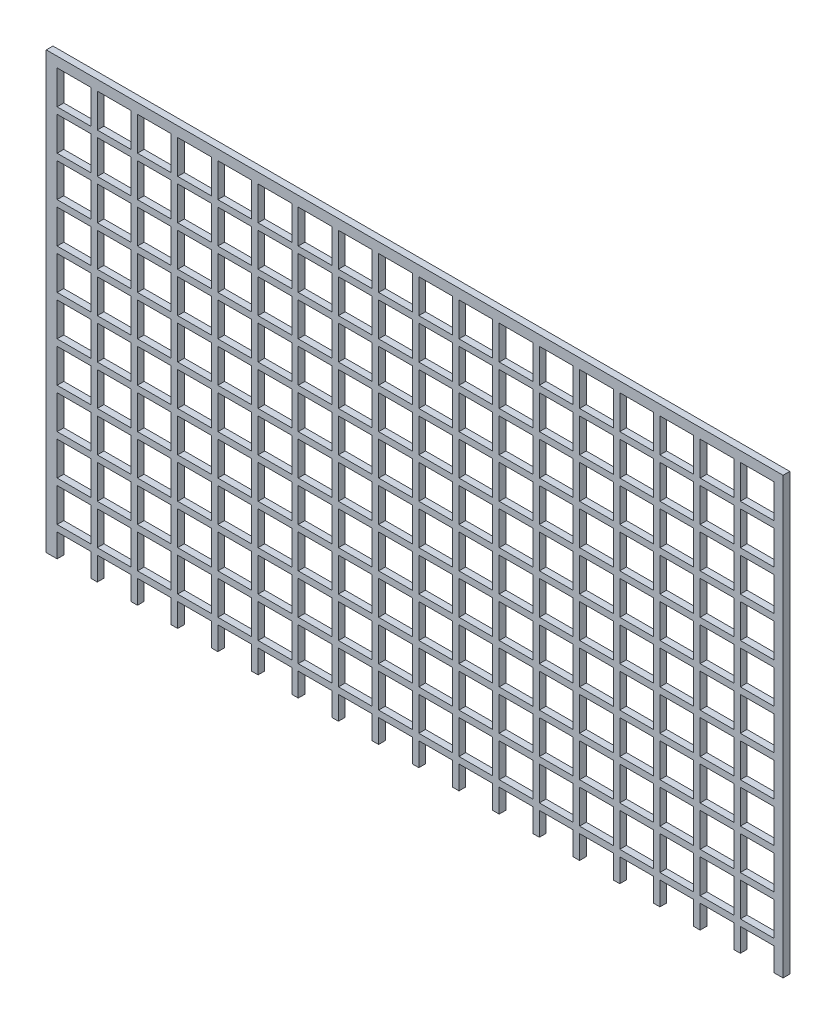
SolidWorks part; units mm, degrees
ref_plane "Front Plane" through (0, 0, 0) normal (0, 0, 1) x (1, 0, 0)
ref_plane "Top Plane" through (0, 0, 0) normal (0, 1, 0) x (1, 0, 0)
ref_plane "Right Plane" through (0, 0, 0) normal (1, 0, 0) x (0, 0, -1)
sketch "Sketch1" plane through (0, 0, 0) normal (0, 0, 1) x (1, 0, 0)
  line L0 (19.3556, 161.2445) -> (32.1389, 161.2445)
  line L1 (0, 0) -> (279.4, 0)
  line L2 (0, 0) -> (0, 165.1)
  line L3 (0, 165.1) -> (279.4, 165.1)
  line L4 (279.4, 0) -> (279.4, 165.1)
  line L5 (4.1156, 161.2445) -> (16.8989, 161.2445)
  line L6 (4.1156, 161.2445) -> (4.1156, 148.4612)
  line L7 (4.1156, 148.4612) -> (16.8989, 148.4612)
  line L8 (16.8989, 161.2445) -> (16.8989, 148.4612)
  line L9 (19.3556, 161.2445) -> (19.3556, 148.4612)
  line L10 (19.3556, 148.4612) -> (32.1389, 148.4612)
  line L11 (32.1389, 161.2445) -> (32.1389, 148.4612)
  line L12 (34.5956, 161.2445) -> (47.3789, 161.2445)
  line L13 (34.5956, 161.2445) -> (34.5956, 148.4612)
  line L14 (34.5956, 148.4612) -> (47.3789, 148.4612)
  line L15 (47.3789, 161.2445) -> (47.3789, 148.4612)
  line L16 (49.8356, 161.2445) -> (62.6189, 161.2445)
  line L17 (49.8356, 161.2445) -> (49.8356, 148.4612)
  line L18 (49.8356, 148.4612) -> (62.6189, 148.4612)
  line L19 (62.6189, 161.2445) -> (62.6189, 148.4612)
  line L20 (65.0756, 161.2445) -> (77.8589, 161.2445)
  line L21 (65.0756, 161.2445) -> (65.0756, 148.4612)
  line L22 (65.0756, 148.4612) -> (77.8589, 148.4612)
  line L23 (77.8589, 161.2445) -> (77.8589, 148.4612)
  line L24 (80.3156, 161.2445) -> (93.0989, 161.2445)
  line L25 (80.3156, 161.2445) -> (80.3156, 148.4612)
  line L26 (80.3156, 148.4612) -> (93.0989, 148.4612)
  line L27 (93.0989, 161.2445) -> (93.0989, 148.4612)
  line L28 (95.5556, 161.2445) -> (108.3389, 161.2445)
  line L29 (95.5556, 161.2445) -> (95.5556, 148.4612)
  line L30 (95.5556, 148.4612) -> (108.3389, 148.4612)
  line L31 (108.3389, 161.2445) -> (108.3389, 148.4612)
  line L32 (110.7956, 161.2445) -> (123.5789, 161.2445)
  line L33 (110.7956, 161.2445) -> (110.7956, 148.4612)
  line L34 (110.7956, 148.4612) -> (123.5789, 148.4612)
  line L35 (123.5789, 161.2445) -> (123.5789, 148.4612)
  line L36 (126.0356, 161.2445) -> (138.8189, 161.2445)
  line L37 (126.0356, 161.2445) -> (126.0356, 148.4612)
  line L38 (126.0356, 148.4612) -> (138.8189, 148.4612)
  line L39 (138.8189, 161.2445) -> (138.8189, 148.4612)
  line L40 (141.2756, 161.2445) -> (154.0589, 161.2445)
  line L41 (141.2756, 161.2445) -> (141.2756, 148.4612)
  line L42 (141.2756, 148.4612) -> (154.0589, 148.4612)
  line L43 (154.0589, 161.2445) -> (154.0589, 148.4612)
  line L44 (156.5156, 161.2445) -> (169.2989, 161.2445)
  line L45 (156.5156, 161.2445) -> (156.5156, 148.4612)
  line L46 (156.5156, 148.4612) -> (169.2989, 148.4612)
  line L47 (169.2989, 161.2445) -> (169.2989, 148.4612)
  line L48 (171.7556, 161.2445) -> (184.5389, 161.2445)
  line L49 (171.7556, 161.2445) -> (171.7556, 148.4612)
  line L50 (171.7556, 148.4612) -> (184.5389, 148.4612)
  line L51 (184.5389, 161.2445) -> (184.5389, 148.4612)
  line L52 (186.9956, 161.2445) -> (199.7789, 161.2445)
  line L53 (186.9956, 161.2445) -> (186.9956, 148.4612)
  line L54 (186.9956, 148.4612) -> (199.7789, 148.4612)
  line L55 (199.7789, 161.2445) -> (199.7789, 148.4612)
  line L56 (202.2356, 161.2445) -> (215.0189, 161.2445)
  line L57 (202.2356, 161.2445) -> (202.2356, 148.4612)
  line L58 (202.2356, 148.4612) -> (215.0189, 148.4612)
  line L59 (215.0189, 161.2445) -> (215.0189, 148.4612)
  line L60 (217.4756, 161.2445) -> (230.2589, 161.2445)
  line L61 (217.4756, 161.2445) -> (217.4756, 148.4612)
  line L62 (217.4756, 148.4612) -> (230.2589, 148.4612)
  line L63 (230.2589, 161.2445) -> (230.2589, 148.4612)
  line L64 (232.7156, 161.2445) -> (245.4989, 161.2445)
  line L65 (232.7156, 161.2445) -> (232.7156, 148.4612)
  line L66 (232.7156, 148.4612) -> (245.4989, 148.4612)
  line L67 (245.4989, 161.2445) -> (245.4989, 148.4612)
  line L68 (247.9556, 161.2445) -> (260.7389, 161.2445)
  line L69 (247.9556, 161.2445) -> (247.9556, 148.4612)
  line L70 (247.9556, 148.4612) -> (260.7389, 148.4612)
  line L71 (260.7389, 161.2445) -> (260.7389, 148.4612)
  line L72 (263.1956, 161.2445) -> (275.9789, 161.2445)
  line L73 (263.1956, 161.2445) -> (263.1956, 148.4612)
  line L74 (263.1956, 148.4612) -> (275.9789, 148.4612)
  line L75 (275.9789, 161.2445) -> (275.9789, 148.4612)
  line L76 (19.3556, 146.0045) -> (32.1389, 146.0045)
  line L77 (19.3556, 146.0045) -> (19.3556, 133.2212)
  line L78 (19.3556, 133.2212) -> (32.1389, 133.2212)
  line L79 (32.1389, 146.0045) -> (32.1389, 133.2212)
  line L80 (34.5956, 146.0045) -> (47.3789, 146.0045)
  line L81 (34.5956, 146.0045) -> (34.5956, 133.2212)
  line L82 (34.5956, 133.2212) -> (47.3789, 133.2212)
  line L83 (47.3789, 146.0045) -> (47.3789, 133.2212)
  line L84 (49.8356, 146.0045) -> (62.6189, 146.0045)
  line L85 (49.8356, 146.0045) -> (49.8356, 133.2212)
  line L86 (49.8356, 133.2212) -> (62.6189, 133.2212)
  line L87 (62.6189, 146.0045) -> (62.6189, 133.2212)
  line L88 (65.0756, 146.0045) -> (77.8589, 146.0045)
  line L89 (65.0756, 146.0045) -> (65.0756, 133.2212)
  line L90 (65.0756, 133.2212) -> (77.8589, 133.2212)
  line L91 (77.8589, 146.0045) -> (77.8589, 133.2212)
  line L92 (80.3156, 146.0045) -> (93.0989, 146.0045)
  line L93 (80.3156, 146.0045) -> (80.3156, 133.2212)
  line L94 (80.3156, 133.2212) -> (93.0989, 133.2212)
  line L95 (93.0989, 146.0045) -> (93.0989, 133.2212)
  line L96 (95.5556, 146.0045) -> (108.3389, 146.0045)
  line L97 (95.5556, 146.0045) -> (95.5556, 133.2212)
  line L98 (95.5556, 133.2212) -> (108.3389, 133.2212)
  line L99 (108.3389, 146.0045) -> (108.3389, 133.2212)
  line L100 (110.7956, 146.0045) -> (123.5789, 146.0045)
  line L101 (110.7956, 146.0045) -> (110.7956, 133.2212)
  line L102 (110.7956, 133.2212) -> (123.5789, 133.2212)
  line L103 (123.5789, 146.0045) -> (123.5789, 133.2212)
  line L104 (126.0356, 146.0045) -> (138.8189, 146.0045)
  line L105 (126.0356, 146.0045) -> (126.0356, 133.2212)
  line L106 (126.0356, 133.2212) -> (138.8189, 133.2212)
  line L107 (138.8189, 146.0045) -> (138.8189, 133.2212)
  line L108 (141.2756, 146.0045) -> (154.0589, 146.0045)
  line L109 (141.2756, 146.0045) -> (141.2756, 133.2212)
  line L110 (141.2756, 133.2212) -> (154.0589, 133.2212)
  line L111 (154.0589, 146.0045) -> (154.0589, 133.2212)
  line L112 (156.5156, 146.0045) -> (169.2989, 146.0045)
  line L113 (156.5156, 146.0045) -> (156.5156, 133.2212)
  line L114 (156.5156, 133.2212) -> (169.2989, 133.2212)
  line L115 (169.2989, 146.0045) -> (169.2989, 133.2212)
  line L116 (171.7556, 146.0045) -> (184.5389, 146.0045)
  line L117 (171.7556, 146.0045) -> (171.7556, 133.2212)
  line L118 (171.7556, 133.2212) -> (184.5389, 133.2212)
  line L119 (184.5389, 146.0045) -> (184.5389, 133.2212)
  line L120 (186.9956, 146.0045) -> (199.7789, 146.0045)
  line L121 (186.9956, 146.0045) -> (186.9956, 133.2212)
  line L122 (186.9956, 133.2212) -> (199.7789, 133.2212)
  line L123 (199.7789, 146.0045) -> (199.7789, 133.2212)
  line L124 (202.2356, 146.0045) -> (215.0189, 146.0045)
  line L125 (202.2356, 146.0045) -> (202.2356, 133.2212)
  line L126 (202.2356, 133.2212) -> (215.0189, 133.2212)
  line L127 (215.0189, 146.0045) -> (215.0189, 133.2212)
  line L128 (217.4756, 146.0045) -> (230.2589, 146.0045)
  line L129 (217.4756, 146.0045) -> (217.4756, 133.2212)
  line L130 (217.4756, 133.2212) -> (230.2589, 133.2212)
  line L131 (230.2589, 146.0045) -> (230.2589, 133.2212)
  line L132 (232.7156, 146.0045) -> (245.4989, 146.0045)
  line L133 (232.7156, 146.0045) -> (232.7156, 133.2212)
  line L134 (232.7156, 133.2212) -> (245.4989, 133.2212)
  line L135 (245.4989, 146.0045) -> (245.4989, 133.2212)
  line L136 (247.9556, 146.0045) -> (260.7389, 146.0045)
  line L137 (247.9556, 146.0045) -> (247.9556, 133.2212)
  line L138 (247.9556, 133.2212) -> (260.7389, 133.2212)
  line L139 (260.7389, 146.0045) -> (260.7389, 133.2212)
  line L140 (263.1956, 146.0045) -> (275.9789, 146.0045)
  line L141 (263.1956, 146.0045) -> (263.1956, 133.2212)
  line L142 (263.1956, 133.2212) -> (275.9789, 133.2212)
  line L143 (275.9789, 146.0045) -> (275.9789, 133.2212)
  line L144 (19.3556, 130.7645) -> (32.1389, 130.7645)
  line L145 (19.3556, 130.7645) -> (19.3556, 117.9812)
  line L146 (19.3556, 117.9812) -> (32.1389, 117.9812)
  line L147 (32.1389, 130.7645) -> (32.1389, 117.9812)
  line L148 (34.5956, 130.7645) -> (47.3789, 130.7645)
  line L149 (34.5956, 130.7645) -> (34.5956, 117.9812)
  line L150 (34.5956, 117.9812) -> (47.3789, 117.9812)
  line L151 (47.3789, 130.7645) -> (47.3789, 117.9812)
  line L152 (49.8356, 130.7645) -> (62.6189, 130.7645)
  line L153 (49.8356, 130.7645) -> (49.8356, 117.9812)
  line L154 (49.8356, 117.9812) -> (62.6189, 117.9812)
  line L155 (62.6189, 130.7645) -> (62.6189, 117.9812)
  line L156 (65.0756, 130.7645) -> (77.8589, 130.7645)
  line L157 (65.0756, 130.7645) -> (65.0756, 117.9812)
  line L158 (65.0756, 117.9812) -> (77.8589, 117.9812)
  line L159 (77.8589, 130.7645) -> (77.8589, 117.9812)
  line L160 (80.3156, 130.7645) -> (93.0989, 130.7645)
  line L161 (80.3156, 130.7645) -> (80.3156, 117.9812)
  line L162 (80.3156, 117.9812) -> (93.0989, 117.9812)
  line L163 (93.0989, 130.7645) -> (93.0989, 117.9812)
  line L164 (95.5556, 130.7645) -> (108.3389, 130.7645)
  line L165 (95.5556, 130.7645) -> (95.5556, 117.9812)
  line L166 (95.5556, 117.9812) -> (108.3389, 117.9812)
  line L167 (108.3389, 130.7645) -> (108.3389, 117.9812)
  line L168 (110.7956, 130.7645) -> (123.5789, 130.7645)
  line L169 (110.7956, 130.7645) -> (110.7956, 117.9812)
  line L170 (110.7956, 117.9812) -> (123.5789, 117.9812)
  line L171 (123.5789, 130.7645) -> (123.5789, 117.9812)
  line L172 (126.0356, 130.7645) -> (138.8189, 130.7645)
  line L173 (126.0356, 130.7645) -> (126.0356, 117.9812)
  line L174 (126.0356, 117.9812) -> (138.8189, 117.9812)
  line L175 (138.8189, 130.7645) -> (138.8189, 117.9812)
  line L176 (141.2756, 130.7645) -> (154.0589, 130.7645)
  line L177 (141.2756, 130.7645) -> (141.2756, 117.9812)
  line L178 (141.2756, 117.9812) -> (154.0589, 117.9812)
  line L179 (154.0589, 130.7645) -> (154.0589, 117.9812)
  line L180 (156.5156, 130.7645) -> (169.2989, 130.7645)
  line L181 (156.5156, 130.7645) -> (156.5156, 117.9812)
  line L182 (156.5156, 117.9812) -> (169.2989, 117.9812)
  line L183 (169.2989, 130.7645) -> (169.2989, 117.9812)
  line L184 (171.7556, 130.7645) -> (184.5389, 130.7645)
  line L185 (171.7556, 130.7645) -> (171.7556, 117.9812)
  line L186 (171.7556, 117.9812) -> (184.5389, 117.9812)
  line L187 (184.5389, 130.7645) -> (184.5389, 117.9812)
  line L188 (186.9956, 130.7645) -> (199.7789, 130.7645)
  line L189 (186.9956, 130.7645) -> (186.9956, 117.9812)
  line L190 (186.9956, 117.9812) -> (199.7789, 117.9812)
  line L191 (199.7789, 130.7645) -> (199.7789, 117.9812)
  line L192 (202.2356, 130.7645) -> (215.0189, 130.7645)
  line L193 (202.2356, 130.7645) -> (202.2356, 117.9812)
  line L194 (202.2356, 117.9812) -> (215.0189, 117.9812)
  line L195 (215.0189, 130.7645) -> (215.0189, 117.9812)
  line L196 (217.4756, 130.7645) -> (230.2589, 130.7645)
  line L197 (217.4756, 130.7645) -> (217.4756, 117.9812)
  line L198 (217.4756, 117.9812) -> (230.2589, 117.9812)
  line L199 (230.2589, 130.7645) -> (230.2589, 117.9812)
  line L200 (232.7156, 130.7645) -> (245.4989, 130.7645)
  line L201 (232.7156, 130.7645) -> (232.7156, 117.9812)
  line L202 (232.7156, 117.9812) -> (245.4989, 117.9812)
  line L203 (245.4989, 130.7645) -> (245.4989, 117.9812)
  line L204 (247.9556, 130.7645) -> (260.7389, 130.7645)
  line L205 (247.9556, 130.7645) -> (247.9556, 117.9812)
  line L206 (247.9556, 117.9812) -> (260.7389, 117.9812)
  line L207 (260.7389, 130.7645) -> (260.7389, 117.9812)
  line L208 (263.1956, 130.7645) -> (275.9789, 130.7645)
  line L209 (263.1956, 130.7645) -> (263.1956, 117.9812)
  line L210 (263.1956, 117.9812) -> (275.9789, 117.9812)
  line L211 (275.9789, 130.7645) -> (275.9789, 117.9812)
  line L212 (19.3556, 115.5245) -> (32.1389, 115.5245)
  line L213 (19.3556, 115.5245) -> (19.3556, 102.7412)
  line L214 (19.3556, 102.7412) -> (32.1389, 102.7412)
  line L215 (32.1389, 115.5245) -> (32.1389, 102.7412)
  line L216 (34.5956, 115.5245) -> (47.3789, 115.5245)
  line L217 (34.5956, 115.5245) -> (34.5956, 102.7412)
  line L218 (34.5956, 102.7412) -> (47.3789, 102.7412)
  line L219 (47.3789, 115.5245) -> (47.3789, 102.7412)
  line L220 (49.8356, 115.5245) -> (62.6189, 115.5245)
  line L221 (49.8356, 115.5245) -> (49.8356, 102.7412)
  line L222 (49.8356, 102.7412) -> (62.6189, 102.7412)
  line L223 (62.6189, 115.5245) -> (62.6189, 102.7412)
  line L224 (65.0756, 115.5245) -> (77.8589, 115.5245)
  line L225 (65.0756, 115.5245) -> (65.0756, 102.7412)
  line L226 (65.0756, 102.7412) -> (77.8589, 102.7412)
  line L227 (77.8589, 115.5245) -> (77.8589, 102.7412)
  line L228 (80.3156, 115.5245) -> (93.0989, 115.5245)
  line L229 (80.3156, 115.5245) -> (80.3156, 102.7412)
  line L230 (80.3156, 102.7412) -> (93.0989, 102.7412)
  line L231 (93.0989, 115.5245) -> (93.0989, 102.7412)
  line L232 (95.5556, 115.5245) -> (108.3389, 115.5245)
  line L233 (95.5556, 115.5245) -> (95.5556, 102.7412)
  line L234 (95.5556, 102.7412) -> (108.3389, 102.7412)
  line L235 (108.3389, 115.5245) -> (108.3389, 102.7412)
  line L236 (110.7956, 115.5245) -> (123.5789, 115.5245)
  line L237 (110.7956, 115.5245) -> (110.7956, 102.7412)
  line L238 (110.7956, 102.7412) -> (123.5789, 102.7412)
  line L239 (123.5789, 115.5245) -> (123.5789, 102.7412)
  line L240 (126.0356, 115.5245) -> (138.8189, 115.5245)
  line L241 (126.0356, 115.5245) -> (126.0356, 102.7412)
  line L242 (126.0356, 102.7412) -> (138.8189, 102.7412)
  line L243 (138.8189, 115.5245) -> (138.8189, 102.7412)
  line L244 (141.2756, 115.5245) -> (154.0589, 115.5245)
  line L245 (141.2756, 115.5245) -> (141.2756, 102.7412)
  line L246 (141.2756, 102.7412) -> (154.0589, 102.7412)
  line L247 (154.0589, 115.5245) -> (154.0589, 102.7412)
  line L248 (156.5156, 115.5245) -> (169.2989, 115.5245)
  line L249 (156.5156, 115.5245) -> (156.5156, 102.7412)
  line L250 (156.5156, 102.7412) -> (169.2989, 102.7412)
  line L251 (169.2989, 115.5245) -> (169.2989, 102.7412)
  line L252 (171.7556, 115.5245) -> (184.5389, 115.5245)
  line L253 (171.7556, 115.5245) -> (171.7556, 102.7412)
  line L254 (171.7556, 102.7412) -> (184.5389, 102.7412)
  line L255 (184.5389, 115.5245) -> (184.5389, 102.7412)
  line L256 (186.9956, 115.5245) -> (199.7789, 115.5245)
  line L257 (186.9956, 115.5245) -> (186.9956, 102.7412)
  line L258 (186.9956, 102.7412) -> (199.7789, 102.7412)
  line L259 (199.7789, 115.5245) -> (199.7789, 102.7412)
  line L260 (202.2356, 115.5245) -> (215.0189, 115.5245)
  line L261 (202.2356, 115.5245) -> (202.2356, 102.7412)
  line L262 (202.2356, 102.7412) -> (215.0189, 102.7412)
  line L263 (215.0189, 115.5245) -> (215.0189, 102.7412)
  line L264 (217.4756, 115.5245) -> (230.2589, 115.5245)
  line L265 (217.4756, 115.5245) -> (217.4756, 102.7412)
  line L266 (217.4756, 102.7412) -> (230.2589, 102.7412)
  line L267 (230.2589, 115.5245) -> (230.2589, 102.7412)
  line L268 (232.7156, 115.5245) -> (245.4989, 115.5245)
  line L269 (232.7156, 115.5245) -> (232.7156, 102.7412)
  line L270 (232.7156, 102.7412) -> (245.4989, 102.7412)
  line L271 (245.4989, 115.5245) -> (245.4989, 102.7412)
  line L272 (247.9556, 115.5245) -> (260.7389, 115.5245)
  line L273 (247.9556, 115.5245) -> (247.9556, 102.7412)
  line L274 (247.9556, 102.7412) -> (260.7389, 102.7412)
  line L275 (260.7389, 115.5245) -> (260.7389, 102.7412)
  line L276 (263.1956, 115.5245) -> (275.9789, 115.5245)
  line L277 (263.1956, 115.5245) -> (263.1956, 102.7412)
  line L278 (263.1956, 102.7412) -> (275.9789, 102.7412)
  line L279 (275.9789, 115.5245) -> (275.9789, 102.7412)
  line L280 (19.3556, 100.2845) -> (32.1389, 100.2845)
  line L281 (19.3556, 100.2845) -> (19.3556, 87.5012)
  line L282 (19.3556, 87.5012) -> (32.1389, 87.5012)
  line L283 (32.1389, 100.2845) -> (32.1389, 87.5012)
  line L284 (34.5956, 100.2845) -> (47.3789, 100.2845)
  line L285 (34.5956, 100.2845) -> (34.5956, 87.5012)
  line L286 (34.5956, 87.5012) -> (47.3789, 87.5012)
  line L287 (47.3789, 100.2845) -> (47.3789, 87.5012)
  line L288 (49.8356, 100.2845) -> (62.6189, 100.2845)
  line L289 (49.8356, 100.2845) -> (49.8356, 87.5012)
  line L290 (49.8356, 87.5012) -> (62.6189, 87.5012)
  line L291 (62.6189, 100.2845) -> (62.6189, 87.5012)
  line L292 (65.0756, 100.2845) -> (77.8589, 100.2845)
  line L293 (65.0756, 100.2845) -> (65.0756, 87.5012)
  line L294 (65.0756, 87.5012) -> (77.8589, 87.5012)
  line L295 (77.8589, 100.2845) -> (77.8589, 87.5012)
  line L296 (80.3156, 100.2845) -> (93.0989, 100.2845)
  line L297 (80.3156, 100.2845) -> (80.3156, 87.5012)
  line L298 (80.3156, 87.5012) -> (93.0989, 87.5012)
  line L299 (93.0989, 100.2845) -> (93.0989, 87.5012)
  line L300 (95.5556, 100.2845) -> (108.3389, 100.2845)
  line L301 (95.5556, 100.2845) -> (95.5556, 87.5012)
  line L302 (95.5556, 87.5012) -> (108.3389, 87.5012)
  line L303 (108.3389, 100.2845) -> (108.3389, 87.5012)
  line L304 (110.7956, 100.2845) -> (123.5789, 100.2845)
  line L305 (110.7956, 100.2845) -> (110.7956, 87.5012)
  line L306 (110.7956, 87.5012) -> (123.5789, 87.5012)
  line L307 (123.5789, 100.2845) -> (123.5789, 87.5012)
  line L308 (126.0356, 100.2845) -> (138.8189, 100.2845)
  line L309 (126.0356, 100.2845) -> (126.0356, 87.5012)
  line L310 (126.0356, 87.5012) -> (138.8189, 87.5012)
  line L311 (138.8189, 100.2845) -> (138.8189, 87.5012)
  line L312 (141.2756, 100.2845) -> (154.0589, 100.2845)
  line L313 (141.2756, 100.2845) -> (141.2756, 87.5012)
  line L314 (141.2756, 87.5012) -> (154.0589, 87.5012)
  line L315 (154.0589, 100.2845) -> (154.0589, 87.5012)
  line L316 (156.5156, 100.2845) -> (169.2989, 100.2845)
  line L317 (156.5156, 100.2845) -> (156.5156, 87.5012)
  line L318 (156.5156, 87.5012) -> (169.2989, 87.5012)
  line L319 (169.2989, 100.2845) -> (169.2989, 87.5012)
  line L320 (171.7556, 100.2845) -> (184.5389, 100.2845)
  line L321 (171.7556, 100.2845) -> (171.7556, 87.5012)
  line L322 (171.7556, 87.5012) -> (184.5389, 87.5012)
  line L323 (184.5389, 100.2845) -> (184.5389, 87.5012)
  line L324 (186.9956, 100.2845) -> (199.7789, 100.2845)
  line L325 (186.9956, 100.2845) -> (186.9956, 87.5012)
  line L326 (186.9956, 87.5012) -> (199.7789, 87.5012)
  line L327 (199.7789, 100.2845) -> (199.7789, 87.5012)
  line L328 (202.2356, 100.2845) -> (215.0189, 100.2845)
  line L329 (202.2356, 100.2845) -> (202.2356, 87.5012)
  line L330 (202.2356, 87.5012) -> (215.0189, 87.5012)
  line L331 (215.0189, 100.2845) -> (215.0189, 87.5012)
  line L332 (217.4756, 100.2845) -> (230.2589, 100.2845)
  line L333 (217.4756, 100.2845) -> (217.4756, 87.5012)
  line L334 (217.4756, 87.5012) -> (230.2589, 87.5012)
  line L335 (230.2589, 100.2845) -> (230.2589, 87.5012)
  line L336 (232.7156, 100.2845) -> (245.4989, 100.2845)
  line L337 (232.7156, 100.2845) -> (232.7156, 87.5012)
  line L338 (232.7156, 87.5012) -> (245.4989, 87.5012)
  line L339 (245.4989, 100.2845) -> (245.4989, 87.5012)
  line L340 (247.9556, 100.2845) -> (260.7389, 100.2845)
  line L341 (247.9556, 100.2845) -> (247.9556, 87.5012)
  line L342 (247.9556, 87.5012) -> (260.7389, 87.5012)
  line L343 (260.7389, 100.2845) -> (260.7389, 87.5012)
  line L344 (263.1956, 100.2845) -> (275.9789, 100.2845)
  line L345 (263.1956, 100.2845) -> (263.1956, 87.5012)
  line L346 (263.1956, 87.5012) -> (275.9789, 87.5012)
  line L347 (275.9789, 100.2845) -> (275.9789, 87.5012)
  line L348 (19.3556, 85.0445) -> (32.1389, 85.0445)
  line L349 (19.3556, 85.0445) -> (19.3556, 72.2612)
  line L350 (19.3556, 72.2612) -> (32.1389, 72.2612)
  line L351 (32.1389, 85.0445) -> (32.1389, 72.2612)
  line L352 (34.5956, 85.0445) -> (47.3789, 85.0445)
  line L353 (34.5956, 85.0445) -> (34.5956, 72.2612)
  line L354 (34.5956, 72.2612) -> (47.3789, 72.2612)
  line L355 (47.3789, 85.0445) -> (47.3789, 72.2612)
  line L356 (49.8356, 85.0445) -> (62.6189, 85.0445)
  line L357 (49.8356, 85.0445) -> (49.8356, 72.2612)
  line L358 (49.8356, 72.2612) -> (62.6189, 72.2612)
  line L359 (62.6189, 85.0445) -> (62.6189, 72.2612)
  line L360 (65.0756, 85.0445) -> (77.8589, 85.0445)
  line L361 (65.0756, 85.0445) -> (65.0756, 72.2612)
  line L362 (65.0756, 72.2612) -> (77.8589, 72.2612)
  line L363 (77.8589, 85.0445) -> (77.8589, 72.2612)
  line L364 (80.3156, 85.0445) -> (93.0989, 85.0445)
  line L365 (80.3156, 85.0445) -> (80.3156, 72.2612)
  line L366 (80.3156, 72.2612) -> (93.0989, 72.2612)
  line L367 (93.0989, 85.0445) -> (93.0989, 72.2612)
  line L368 (95.5556, 85.0445) -> (108.3389, 85.0445)
  line L369 (95.5556, 85.0445) -> (95.5556, 72.2612)
  line L370 (95.5556, 72.2612) -> (108.3389, 72.2612)
  line L371 (108.3389, 85.0445) -> (108.3389, 72.2612)
  line L372 (110.7956, 85.0445) -> (123.5789, 85.0445)
  line L373 (110.7956, 85.0445) -> (110.7956, 72.2612)
  line L374 (110.7956, 72.2612) -> (123.5789, 72.2612)
  line L375 (123.5789, 85.0445) -> (123.5789, 72.2612)
  line L376 (126.0356, 85.0445) -> (138.8189, 85.0445)
  line L377 (126.0356, 85.0445) -> (126.0356, 72.2612)
  line L378 (126.0356, 72.2612) -> (138.8189, 72.2612)
  line L379 (138.8189, 85.0445) -> (138.8189, 72.2612)
  line L380 (141.2756, 85.0445) -> (154.0589, 85.0445)
  line L381 (141.2756, 85.0445) -> (141.2756, 72.2612)
  line L382 (141.2756, 72.2612) -> (154.0589, 72.2612)
  line L383 (154.0589, 85.0445) -> (154.0589, 72.2612)
  line L384 (156.5156, 85.0445) -> (169.2989, 85.0445)
  line L385 (156.5156, 85.0445) -> (156.5156, 72.2612)
  line L386 (156.5156, 72.2612) -> (169.2989, 72.2612)
  line L387 (169.2989, 85.0445) -> (169.2989, 72.2612)
  line L388 (171.7556, 85.0445) -> (184.5389, 85.0445)
  line L389 (171.7556, 85.0445) -> (171.7556, 72.2612)
  line L390 (171.7556, 72.2612) -> (184.5389, 72.2612)
  line L391 (184.5389, 85.0445) -> (184.5389, 72.2612)
  line L392 (186.9956, 85.0445) -> (199.7789, 85.0445)
  line L393 (186.9956, 85.0445) -> (186.9956, 72.2612)
  line L394 (186.9956, 72.2612) -> (199.7789, 72.2612)
  line L395 (199.7789, 85.0445) -> (199.7789, 72.2612)
  line L396 (202.2356, 85.0445) -> (215.0189, 85.0445)
  line L397 (202.2356, 85.0445) -> (202.2356, 72.2612)
  line L398 (202.2356, 72.2612) -> (215.0189, 72.2612)
  line L399 (215.0189, 85.0445) -> (215.0189, 72.2612)
  line L400 (217.4756, 85.0445) -> (230.2589, 85.0445)
  line L401 (217.4756, 85.0445) -> (217.4756, 72.2612)
  line L402 (217.4756, 72.2612) -> (230.2589, 72.2612)
  line L403 (230.2589, 85.0445) -> (230.2589, 72.2612)
  line L404 (232.7156, 85.0445) -> (245.4989, 85.0445)
  line L405 (232.7156, 85.0445) -> (232.7156, 72.2612)
  line L406 (232.7156, 72.2612) -> (245.4989, 72.2612)
  line L407 (245.4989, 85.0445) -> (245.4989, 72.2612)
  line L408 (247.9556, 85.0445) -> (260.7389, 85.0445)
  line L409 (247.9556, 85.0445) -> (247.9556, 72.2612)
  line L410 (247.9556, 72.2612) -> (260.7389, 72.2612)
  line L411 (260.7389, 85.0445) -> (260.7389, 72.2612)
  line L412 (263.1956, 85.0445) -> (275.9789, 85.0445)
  line L413 (263.1956, 85.0445) -> (263.1956, 72.2612)
  line L414 (263.1956, 72.2612) -> (275.9789, 72.2612)
  line L415 (275.9789, 85.0445) -> (275.9789, 72.2612)
  line L416 (19.3556, 69.8045) -> (32.1389, 69.8045)
  line L417 (19.3556, 69.8045) -> (19.3556, 57.0212)
  line L418 (19.3556, 57.0212) -> (32.1389, 57.0212)
  line L419 (32.1389, 69.8045) -> (32.1389, 57.0212)
  line L420 (34.5956, 69.8045) -> (47.3789, 69.8045)
  line L421 (34.5956, 69.8045) -> (34.5956, 57.0212)
  line L422 (34.5956, 57.0212) -> (47.3789, 57.0212)
  line L423 (47.3789, 69.8045) -> (47.3789, 57.0212)
  line L424 (49.8356, 69.8045) -> (62.6189, 69.8045)
  line L425 (49.8356, 69.8045) -> (49.8356, 57.0212)
  line L426 (49.8356, 57.0212) -> (62.6189, 57.0212)
  line L427 (62.6189, 69.8045) -> (62.6189, 57.0212)
  line L428 (65.0756, 69.8045) -> (77.8589, 69.8045)
  line L429 (65.0756, 69.8045) -> (65.0756, 57.0212)
  line L430 (65.0756, 57.0212) -> (77.8589, 57.0212)
  line L431 (77.8589, 69.8045) -> (77.8589, 57.0212)
  line L432 (80.3156, 69.8045) -> (93.0989, 69.8045)
  line L433 (80.3156, 69.8045) -> (80.3156, 57.0212)
  line L434 (80.3156, 57.0212) -> (93.0989, 57.0212)
  line L435 (93.0989, 69.8045) -> (93.0989, 57.0212)
  line L436 (95.5556, 69.8045) -> (108.3389, 69.8045)
  line L437 (95.5556, 69.8045) -> (95.5556, 57.0212)
  line L438 (95.5556, 57.0212) -> (108.3389, 57.0212)
  line L439 (108.3389, 69.8045) -> (108.3389, 57.0212)
  line L440 (110.7956, 69.8045) -> (123.5789, 69.8045)
  line L441 (110.7956, 69.8045) -> (110.7956, 57.0212)
  line L442 (110.7956, 57.0212) -> (123.5789, 57.0212)
  line L443 (123.5789, 69.8045) -> (123.5789, 57.0212)
  line L444 (126.0356, 69.8045) -> (138.8189, 69.8045)
  line L445 (126.0356, 69.8045) -> (126.0356, 57.0212)
  line L446 (126.0356, 57.0212) -> (138.8189, 57.0212)
  line L447 (138.8189, 69.8045) -> (138.8189, 57.0212)
  line L448 (141.2756, 69.8045) -> (154.0589, 69.8045)
  line L449 (141.2756, 69.8045) -> (141.2756, 57.0212)
  line L450 (141.2756, 57.0212) -> (154.0589, 57.0212)
  line L451 (154.0589, 69.8045) -> (154.0589, 57.0212)
  line L452 (156.5156, 69.8045) -> (169.2989, 69.8045)
  line L453 (156.5156, 69.8045) -> (156.5156, 57.0212)
  line L454 (156.5156, 57.0212) -> (169.2989, 57.0212)
  line L455 (169.2989, 69.8045) -> (169.2989, 57.0212)
  line L456 (171.7556, 69.8045) -> (184.5389, 69.8045)
  line L457 (171.7556, 69.8045) -> (171.7556, 57.0212)
  line L458 (171.7556, 57.0212) -> (184.5389, 57.0212)
  line L459 (184.5389, 69.8045) -> (184.5389, 57.0212)
  line L460 (186.9956, 69.8045) -> (199.7789, 69.8045)
  line L461 (186.9956, 69.8045) -> (186.9956, 57.0212)
  line L462 (186.9956, 57.0212) -> (199.7789, 57.0212)
  line L463 (199.7789, 69.8045) -> (199.7789, 57.0212)
  line L464 (202.2356, 69.8045) -> (215.0189, 69.8045)
  line L465 (202.2356, 69.8045) -> (202.2356, 57.0212)
  line L466 (202.2356, 57.0212) -> (215.0189, 57.0212)
  line L467 (215.0189, 69.8045) -> (215.0189, 57.0212)
  line L468 (217.4756, 69.8045) -> (230.2589, 69.8045)
  line L469 (217.4756, 69.8045) -> (217.4756, 57.0212)
  line L470 (217.4756, 57.0212) -> (230.2589, 57.0212)
  line L471 (230.2589, 69.8045) -> (230.2589, 57.0212)
  line L472 (232.7156, 69.8045) -> (245.4989, 69.8045)
  line L473 (232.7156, 69.8045) -> (232.7156, 57.0212)
  line L474 (232.7156, 57.0212) -> (245.4989, 57.0212)
  line L475 (245.4989, 69.8045) -> (245.4989, 57.0212)
  line L476 (247.9556, 69.8045) -> (260.7389, 69.8045)
  line L477 (247.9556, 69.8045) -> (247.9556, 57.0212)
  line L478 (247.9556, 57.0212) -> (260.7389, 57.0212)
  line L479 (260.7389, 69.8045) -> (260.7389, 57.0212)
  line L480 (263.1956, 69.8045) -> (275.9789, 69.8045)
  line L481 (263.1956, 69.8045) -> (263.1956, 57.0212)
  line L482 (263.1956, 57.0212) -> (275.9789, 57.0212)
  line L483 (275.9789, 69.8045) -> (275.9789, 57.0212)
  line L484 (19.3556, 54.5645) -> (32.1389, 54.5645)
  line L485 (19.3556, 54.5645) -> (19.3556, 41.7812)
  line L486 (19.3556, 41.7812) -> (32.1389, 41.7812)
  line L487 (32.1389, 54.5645) -> (32.1389, 41.7812)
  line L488 (34.5956, 54.5645) -> (47.3789, 54.5645)
  line L489 (34.5956, 54.5645) -> (34.5956, 41.7812)
  line L490 (34.5956, 41.7812) -> (47.3789, 41.7812)
  line L491 (47.3789, 54.5645) -> (47.3789, 41.7812)
  line L492 (49.8356, 54.5645) -> (62.6189, 54.5645)
  line L493 (49.8356, 54.5645) -> (49.8356, 41.7812)
  line L494 (49.8356, 41.7812) -> (62.6189, 41.7812)
  line L495 (62.6189, 54.5645) -> (62.6189, 41.7812)
  line L496 (65.0756, 54.5645) -> (77.8589, 54.5645)
  line L497 (65.0756, 54.5645) -> (65.0756, 41.7812)
  line L498 (65.0756, 41.7812) -> (77.8589, 41.7812)
  line L499 (77.8589, 54.5645) -> (77.8589, 41.7812)
  line L500 (80.3156, 54.5645) -> (93.0989, 54.5645)
  line L501 (80.3156, 54.5645) -> (80.3156, 41.7812)
  line L502 (80.3156, 41.7812) -> (93.0989, 41.7812)
  line L503 (93.0989, 54.5645) -> (93.0989, 41.7812)
  line L504 (95.5556, 54.5645) -> (108.3389, 54.5645)
  line L505 (95.5556, 54.5645) -> (95.5556, 41.7812)
  line L506 (95.5556, 41.7812) -> (108.3389, 41.7812)
  line L507 (108.3389, 54.5645) -> (108.3389, 41.7812)
  line L508 (110.7956, 54.5645) -> (123.5789, 54.5645)
  line L509 (110.7956, 54.5645) -> (110.7956, 41.7812)
  line L510 (110.7956, 41.7812) -> (123.5789, 41.7812)
  line L511 (123.5789, 54.5645) -> (123.5789, 41.7812)
  line L512 (126.0356, 54.5645) -> (138.8189, 54.5645)
  line L513 (126.0356, 54.5645) -> (126.0356, 41.7812)
  line L514 (126.0356, 41.7812) -> (138.8189, 41.7812)
  line L515 (138.8189, 54.5645) -> (138.8189, 41.7812)
  line L516 (141.2756, 54.5645) -> (154.0589, 54.5645)
  line L517 (141.2756, 54.5645) -> (141.2756, 41.7812)
  line L518 (141.2756, 41.7812) -> (154.0589, 41.7812)
  line L519 (154.0589, 54.5645) -> (154.0589, 41.7812)
  line L520 (156.5156, 54.5645) -> (169.2989, 54.5645)
  line L521 (156.5156, 54.5645) -> (156.5156, 41.7812)
  line L522 (156.5156, 41.7812) -> (169.2989, 41.7812)
  line L523 (169.2989, 54.5645) -> (169.2989, 41.7812)
  line L524 (171.7556, 54.5645) -> (184.5389, 54.5645)
  line L525 (171.7556, 54.5645) -> (171.7556, 41.7812)
  line L526 (171.7556, 41.7812) -> (184.5389, 41.7812)
  line L527 (184.5389, 54.5645) -> (184.5389, 41.7812)
  line L528 (186.9956, 54.5645) -> (199.7789, 54.5645)
  line L529 (186.9956, 54.5645) -> (186.9956, 41.7812)
  line L530 (186.9956, 41.7812) -> (199.7789, 41.7812)
  line L531 (199.7789, 54.5645) -> (199.7789, 41.7812)
  line L532 (202.2356, 54.5645) -> (215.0189, 54.5645)
  line L533 (202.2356, 54.5645) -> (202.2356, 41.7812)
  line L534 (202.2356, 41.7812) -> (215.0189, 41.7812)
  line L535 (215.0189, 54.5645) -> (215.0189, 41.7812)
  line L536 (217.4756, 54.5645) -> (230.2589, 54.5645)
  line L537 (217.4756, 54.5645) -> (217.4756, 41.7812)
  line L538 (217.4756, 41.7812) -> (230.2589, 41.7812)
  line L539 (230.2589, 54.5645) -> (230.2589, 41.7812)
  line L540 (232.7156, 54.5645) -> (245.4989, 54.5645)
  line L541 (232.7156, 54.5645) -> (232.7156, 41.7812)
  line L542 (232.7156, 41.7812) -> (245.4989, 41.7812)
  line L543 (245.4989, 54.5645) -> (245.4989, 41.7812)
  line L544 (247.9556, 54.5645) -> (260.7389, 54.5645)
  line L545 (247.9556, 54.5645) -> (247.9556, 41.7812)
  line L546 (247.9556, 41.7812) -> (260.7389, 41.7812)
  line L547 (260.7389, 54.5645) -> (260.7389, 41.7812)
  line L548 (263.1956, 54.5645) -> (275.9789, 54.5645)
  line L549 (263.1956, 54.5645) -> (263.1956, 41.7812)
  line L550 (263.1956, 41.7812) -> (275.9789, 41.7812)
  line L551 (275.9789, 54.5645) -> (275.9789, 41.7812)
  line L552 (19.3556, 39.3245) -> (32.1389, 39.3245)
  line L553 (19.3556, 39.3245) -> (19.3556, 26.5412)
  line L554 (19.3556, 26.5412) -> (32.1389, 26.5412)
  line L555 (32.1389, 39.3245) -> (32.1389, 26.5412)
  line L556 (34.5956, 39.3245) -> (47.3789, 39.3245)
  line L557 (34.5956, 39.3245) -> (34.5956, 26.5412)
  line L558 (34.5956, 26.5412) -> (47.3789, 26.5412)
  line L559 (47.3789, 39.3245) -> (47.3789, 26.5412)
  line L560 (49.8356, 39.3245) -> (62.6189, 39.3245)
  line L561 (49.8356, 39.3245) -> (49.8356, 26.5412)
  line L562 (49.8356, 26.5412) -> (62.6189, 26.5412)
  line L563 (62.6189, 39.3245) -> (62.6189, 26.5412)
  line L564 (65.0756, 39.3245) -> (77.8589, 39.3245)
  line L565 (65.0756, 39.3245) -> (65.0756, 26.5412)
  line L566 (65.0756, 26.5412) -> (77.8589, 26.5412)
  line L567 (77.8589, 39.3245) -> (77.8589, 26.5412)
  line L568 (80.3156, 39.3245) -> (93.0989, 39.3245)
  line L569 (80.3156, 39.3245) -> (80.3156, 26.5412)
  line L570 (80.3156, 26.5412) -> (93.0989, 26.5412)
  line L571 (93.0989, 39.3245) -> (93.0989, 26.5412)
  line L572 (95.5556, 39.3245) -> (108.3389, 39.3245)
  line L573 (95.5556, 39.3245) -> (95.5556, 26.5412)
  line L574 (95.5556, 26.5412) -> (108.3389, 26.5412)
  line L575 (108.3389, 39.3245) -> (108.3389, 26.5412)
  line L576 (110.7956, 39.3245) -> (123.5789, 39.3245)
  line L577 (110.7956, 39.3245) -> (110.7956, 26.5412)
  line L578 (110.7956, 26.5412) -> (123.5789, 26.5412)
  line L579 (123.5789, 39.3245) -> (123.5789, 26.5412)
  line L580 (126.0356, 39.3245) -> (138.8189, 39.3245)
  line L581 (126.0356, 39.3245) -> (126.0356, 26.5412)
  line L582 (126.0356, 26.5412) -> (138.8189, 26.5412)
  line L583 (138.8189, 39.3245) -> (138.8189, 26.5412)
  line L584 (141.2756, 39.3245) -> (154.0589, 39.3245)
  line L585 (141.2756, 39.3245) -> (141.2756, 26.5412)
  line L586 (141.2756, 26.5412) -> (154.0589, 26.5412)
  line L587 (154.0589, 39.3245) -> (154.0589, 26.5412)
  line L588 (156.5156, 39.3245) -> (169.2989, 39.3245)
  line L589 (156.5156, 39.3245) -> (156.5156, 26.5412)
  line L590 (156.5156, 26.5412) -> (169.2989, 26.5412)
  line L591 (169.2989, 39.3245) -> (169.2989, 26.5412)
  line L592 (171.7556, 39.3245) -> (184.5389, 39.3245)
  line L593 (171.7556, 39.3245) -> (171.7556, 26.5412)
  line L594 (171.7556, 26.5412) -> (184.5389, 26.5412)
  line L595 (184.5389, 39.3245) -> (184.5389, 26.5412)
  line L596 (186.9956, 39.3245) -> (199.7789, 39.3245)
  line L597 (186.9956, 39.3245) -> (186.9956, 26.5412)
  line L598 (186.9956, 26.5412) -> (199.7789, 26.5412)
  line L599 (199.7789, 39.3245) -> (199.7789, 26.5412)
  line L600 (202.2356, 39.3245) -> (215.0189, 39.3245)
  line L601 (202.2356, 39.3245) -> (202.2356, 26.5412)
  line L602 (202.2356, 26.5412) -> (215.0189, 26.5412)
  line L603 (215.0189, 39.3245) -> (215.0189, 26.5412)
  line L604 (217.4756, 39.3245) -> (230.2589, 39.3245)
  line L605 (217.4756, 39.3245) -> (217.4756, 26.5412)
  line L606 (217.4756, 26.5412) -> (230.2589, 26.5412)
  line L607 (230.2589, 39.3245) -> (230.2589, 26.5412)
  line L608 (232.7156, 39.3245) -> (245.4989, 39.3245)
  line L609 (232.7156, 39.3245) -> (232.7156, 26.5412)
  line L610 (232.7156, 26.5412) -> (245.4989, 26.5412)
  line L611 (245.4989, 39.3245) -> (245.4989, 26.5412)
  line L612 (247.9556, 39.3245) -> (260.7389, 39.3245)
  line L613 (247.9556, 39.3245) -> (247.9556, 26.5412)
  line L614 (247.9556, 26.5412) -> (260.7389, 26.5412)
  line L615 (260.7389, 39.3245) -> (260.7389, 26.5412)
  line L616 (263.1956, 39.3245) -> (275.9789, 39.3245)
  line L617 (263.1956, 39.3245) -> (263.1956, 26.5412)
  line L618 (263.1956, 26.5412) -> (275.9789, 26.5412)
  line L619 (275.9789, 39.3245) -> (275.9789, 26.5412)
  line L620 (19.3556, 24.0845) -> (32.1389, 24.0845)
  line L621 (19.3556, 24.0845) -> (19.3556, 11.3012)
  line L622 (19.3556, 11.3012) -> (32.1389, 11.3012)
  line L623 (32.1389, 24.0845) -> (32.1389, 11.3012)
  line L624 (34.5956, 24.0845) -> (47.3789, 24.0845)
  line L625 (34.5956, 24.0845) -> (34.5956, 11.3012)
  line L626 (34.5956, 11.3012) -> (47.3789, 11.3012)
  line L627 (47.3789, 24.0845) -> (47.3789, 11.3012)
  line L628 (49.8356, 24.0845) -> (62.6189, 24.0845)
  line L629 (49.8356, 24.0845) -> (49.8356, 11.3012)
  line L630 (49.8356, 11.3012) -> (62.6189, 11.3012)
  line L631 (62.6189, 24.0845) -> (62.6189, 11.3012)
  line L632 (65.0756, 24.0845) -> (77.8589, 24.0845)
  line L633 (65.0756, 24.0845) -> (65.0756, 11.3012)
  line L634 (65.0756, 11.3012) -> (77.8589, 11.3012)
  line L635 (77.8589, 24.0845) -> (77.8589, 11.3012)
  line L636 (80.3156, 24.0845) -> (93.0989, 24.0845)
  line L637 (80.3156, 24.0845) -> (80.3156, 11.3012)
  line L638 (80.3156, 11.3012) -> (93.0989, 11.3012)
  line L639 (93.0989, 24.0845) -> (93.0989, 11.3012)
  line L640 (95.5556, 24.0845) -> (108.3389, 24.0845)
  line L641 (95.5556, 24.0845) -> (95.5556, 11.3012)
  line L642 (95.5556, 11.3012) -> (108.3389, 11.3012)
  line L643 (108.3389, 24.0845) -> (108.3389, 11.3012)
  line L644 (110.7956, 24.0845) -> (123.5789, 24.0845)
  line L645 (110.7956, 24.0845) -> (110.7956, 11.3012)
  line L646 (110.7956, 11.3012) -> (123.5789, 11.3012)
  line L647 (123.5789, 24.0845) -> (123.5789, 11.3012)
  line L648 (126.0356, 24.0845) -> (138.8189, 24.0845)
  line L649 (126.0356, 24.0845) -> (126.0356, 11.3012)
  line L650 (126.0356, 11.3012) -> (138.8189, 11.3012)
  line L651 (138.8189, 24.0845) -> (138.8189, 11.3012)
  line L652 (141.2756, 24.0845) -> (154.0589, 24.0845)
  line L653 (141.2756, 24.0845) -> (141.2756, 11.3012)
  line L654 (141.2756, 11.3012) -> (154.0589, 11.3012)
  line L655 (154.0589, 24.0845) -> (154.0589, 11.3012)
  line L656 (156.5156, 24.0845) -> (169.2989, 24.0845)
  line L657 (156.5156, 24.0845) -> (156.5156, 11.3012)
  line L658 (156.5156, 11.3012) -> (169.2989, 11.3012)
  line L659 (169.2989, 24.0845) -> (169.2989, 11.3012)
  line L660 (171.7556, 24.0845) -> (184.5389, 24.0845)
  line L661 (171.7556, 24.0845) -> (171.7556, 11.3012)
  line L662 (171.7556, 11.3012) -> (184.5389, 11.3012)
  line L663 (184.5389, 24.0845) -> (184.5389, 11.3012)
  line L664 (186.9956, 24.0845) -> (199.7789, 24.0845)
  line L665 (186.9956, 24.0845) -> (186.9956, 11.3012)
  line L666 (186.9956, 11.3012) -> (199.7789, 11.3012)
  line L667 (199.7789, 24.0845) -> (199.7789, 11.3012)
  line L668 (202.2356, 24.0845) -> (215.0189, 24.0845)
  line L669 (202.2356, 24.0845) -> (202.2356, 11.3012)
  line L670 (202.2356, 11.3012) -> (215.0189, 11.3012)
  line L671 (215.0189, 24.0845) -> (215.0189, 11.3012)
  line L672 (217.4756, 24.0845) -> (230.2589, 24.0845)
  line L673 (217.4756, 24.0845) -> (217.4756, 11.3012)
  line L674 (217.4756, 11.3012) -> (230.2589, 11.3012)
  line L675 (230.2589, 24.0845) -> (230.2589, 11.3012)
  line L676 (232.7156, 24.0845) -> (245.4989, 24.0845)
  line L677 (232.7156, 24.0845) -> (232.7156, 11.3012)
  line L678 (232.7156, 11.3012) -> (245.4989, 11.3012)
  line L679 (245.4989, 24.0845) -> (245.4989, 11.3012)
  line L680 (247.9556, 24.0845) -> (260.7389, 24.0845)
  line L681 (247.9556, 24.0845) -> (247.9556, 11.3012)
  line L682 (247.9556, 11.3012) -> (260.7389, 11.3012)
  line L683 (260.7389, 24.0845) -> (260.7389, 11.3012)
  line L684 (263.1956, 24.0845) -> (275.9789, 24.0845)
  line L685 (263.1956, 24.0845) -> (263.1956, 11.3012)
  line L686 (263.1956, 11.3012) -> (275.9789, 11.3012)
  line L687 (275.9789, 24.0845) -> (275.9789, 11.3012)
  line L688 (4.1156, 146.0045) -> (16.8989, 146.0045)
  line L689 (4.1156, 146.0045) -> (4.1156, 133.2212)
  line L690 (4.1156, 133.2212) -> (16.8989, 133.2212)
  line L691 (16.8989, 146.0045) -> (16.8989, 133.2212)
  line L692 (4.1156, 130.7645) -> (16.8989, 130.7645)
  line L693 (4.1156, 130.7645) -> (4.1156, 117.9812)
  line L694 (4.1156, 117.9812) -> (16.8989, 117.9812)
  line L695 (16.8989, 130.7645) -> (16.8989, 117.9812)
  line L696 (4.1156, 115.5245) -> (16.8989, 115.5245)
  line L697 (4.1156, 115.5245) -> (4.1156, 102.7412)
  line L698 (4.1156, 102.7412) -> (16.8989, 102.7412)
  line L699 (16.8989, 115.5245) -> (16.8989, 102.7412)
  line L700 (4.1156, 100.2845) -> (16.8989, 100.2845)
  line L701 (4.1156, 100.2845) -> (4.1156, 87.5012)
  line L702 (4.1156, 87.5012) -> (16.8989, 87.5012)
  line L703 (16.8989, 100.2845) -> (16.8989, 87.5012)
  line L704 (4.1156, 85.0445) -> (16.8989, 85.0445)
  line L705 (4.1156, 85.0445) -> (4.1156, 72.2612)
  line L706 (4.1156, 72.2612) -> (16.8989, 72.2612)
  line L707 (16.8989, 85.0445) -> (16.8989, 72.2612)
  line L708 (4.1156, 69.8045) -> (16.8989, 69.8045)
  line L709 (4.1156, 69.8045) -> (4.1156, 57.0212)
  line L710 (4.1156, 57.0212) -> (16.8989, 57.0212)
  line L711 (16.8989, 69.8045) -> (16.8989, 57.0212)
  line L712 (4.1156, 54.5645) -> (16.8989, 54.5645)
  line L713 (4.1156, 54.5645) -> (4.1156, 41.7812)
  line L714 (4.1156, 41.7812) -> (16.8989, 41.7812)
  line L715 (16.8989, 54.5645) -> (16.8989, 41.7812)
  line L716 (4.1156, 39.3245) -> (16.8989, 39.3245)
  line L717 (4.1156, 39.3245) -> (4.1156, 26.5412)
  line L718 (4.1156, 26.5412) -> (16.8989, 26.5412)
  line L719 (16.8989, 39.3245) -> (16.8989, 26.5412)
  line L720 (4.1156, 24.0845) -> (16.8989, 24.0845)
  line L721 (4.1156, 24.0845) -> (4.1156, 11.3012)
  line L722 (4.1156, 11.3012) -> (16.8989, 11.3012)
  line L723 (16.8989, 24.0845) -> (16.8989, 11.3012)
  line L724 (4.1156, 8.8445) -> (16.8989, 8.8445)
  line L725 (4.1156, 8.8445) -> (4.1156, -3.9388)
  line L726 (4.1156, -3.9388) -> (16.8989, -3.9388)
  line L727 (16.8989, 8.8445) -> (16.8989, -3.9388)
  line L728 (19.3556, 8.8445) -> (32.1389, 8.8445)
  line L729 (19.3556, 8.8445) -> (19.3556, -3.9388)
  line L730 (19.3556, -3.9388) -> (32.1389, -3.9388)
  line L731 (32.1389, 8.8445) -> (32.1389, -3.9388)
  line L732 (34.5956, 8.8445) -> (47.3789, 8.8445)
  line L733 (34.5956, 8.8445) -> (34.5956, -3.9388)
  line L734 (34.5956, -3.9388) -> (47.3789, -3.9388)
  line L735 (47.3789, 8.8445) -> (47.3789, -3.9388)
  line L736 (49.8356, 8.8445) -> (62.6189, 8.8445)
  line L737 (49.8356, 8.8445) -> (49.8356, -3.9388)
  line L738 (49.8356, -3.9388) -> (62.6189, -3.9388)
  line L739 (62.6189, 8.8445) -> (62.6189, -3.9388)
  line L740 (65.0756, 8.8445) -> (77.8589, 8.8445)
  line L741 (65.0756, 8.8445) -> (65.0756, -3.9388)
  line L742 (65.0756, -3.9388) -> (77.8589, -3.9388)
  line L743 (77.8589, 8.8445) -> (77.8589, -3.9388)
  line L744 (80.3156, 8.8445) -> (93.0989, 8.8445)
  line L745 (80.3156, 8.8445) -> (80.3156, -3.9388)
  line L746 (80.3156, -3.9388) -> (93.0989, -3.9388)
  line L747 (93.0989, 8.8445) -> (93.0989, -3.9388)
  line L748 (95.5556, 8.8445) -> (108.3389, 8.8445)
  line L749 (95.5556, 8.8445) -> (95.5556, -3.9388)
  line L750 (95.5556, -3.9388) -> (108.3389, -3.9388)
  line L751 (108.3389, 8.8445) -> (108.3389, -3.9388)
  line L752 (110.7956, 8.8445) -> (123.5789, 8.8445)
  line L753 (110.7956, 8.8445) -> (110.7956, -3.9388)
  line L754 (110.7956, -3.9388) -> (123.5789, -3.9388)
  line L755 (123.5789, 8.8445) -> (123.5789, -3.9388)
  line L756 (126.0356, 8.8445) -> (138.8189, 8.8445)
  line L757 (126.0356, 8.8445) -> (126.0356, -3.9388)
  line L758 (126.0356, -3.9388) -> (138.8189, -3.9388)
  line L759 (138.8189, 8.8445) -> (138.8189, -3.9388)
  line L760 (141.2756, 8.8445) -> (154.0589, 8.8445)
  line L761 (141.2756, 8.8445) -> (141.2756, -3.9388)
  line L762 (141.2756, -3.9388) -> (154.0589, -3.9388)
  line L763 (154.0589, 8.8445) -> (154.0589, -3.9388)
  line L764 (156.5156, 8.8445) -> (169.2989, 8.8445)
  line L765 (156.5156, 8.8445) -> (156.5156, -3.9388)
  line L766 (156.5156, -3.9388) -> (169.2989, -3.9388)
  line L767 (169.2989, 8.8445) -> (169.2989, -3.9388)
  line L768 (171.7556, 8.8445) -> (184.5389, 8.8445)
  line L769 (171.7556, 8.8445) -> (171.7556, -3.9388)
  line L770 (171.7556, -3.9388) -> (184.5389, -3.9388)
  line L771 (184.5389, 8.8445) -> (184.5389, -3.9388)
  line L772 (186.9956, 8.8445) -> (199.7789, 8.8445)
  line L773 (186.9956, 8.8445) -> (186.9956, -3.9388)
  line L774 (186.9956, -3.9388) -> (199.7789, -3.9388)
  line L775 (199.7789, 8.8445) -> (199.7789, -3.9388)
  line L776 (202.2356, 8.8445) -> (215.0189, 8.8445)
  line L777 (202.2356, 8.8445) -> (202.2356, -3.9388)
  line L778 (202.2356, -3.9388) -> (215.0189, -3.9388)
  line L779 (215.0189, 8.8445) -> (215.0189, -3.9388)
  line L780 (217.4756, 8.8445) -> (230.2589, 8.8445)
  line L781 (217.4756, 8.8445) -> (217.4756, -3.9388)
  line L782 (217.4756, -3.9388) -> (230.2589, -3.9388)
  line L783 (230.2589, 8.8445) -> (230.2589, -3.9388)
  line L784 (232.7156, 8.8445) -> (245.4989, 8.8445)
  line L785 (232.7156, 8.8445) -> (232.7156, -3.9388)
  line L786 (232.7156, -3.9388) -> (245.4989, -3.9388)
  line L787 (245.4989, 8.8445) -> (245.4989, -3.9388)
  line L788 (247.9556, 8.8445) -> (260.7389, 8.8445)
  line L789 (247.9556, 8.8445) -> (247.9556, -3.9388)
  line L790 (247.9556, -3.9388) -> (260.7389, -3.9388)
  line L791 (260.7389, 8.8445) -> (260.7389, -3.9388)
  line L792 (263.1956, 8.8445) -> (275.9789, 8.8445)
  line L793 (263.1956, 8.8445) -> (263.1956, -3.9388)
  line L794 (263.1956, -3.9388) -> (275.9789, -3.9388)
  line L795 (275.9789, 8.8445) -> (275.9789, -3.9388)
  dimension "D1" = 279.4
  dimension "D2" = 165.1
  dimension "D3" = 18
  dimension "D4" = 11
extrude "Boss-Extrude1" add sketch "Sketch1" along normal blind 2.54
